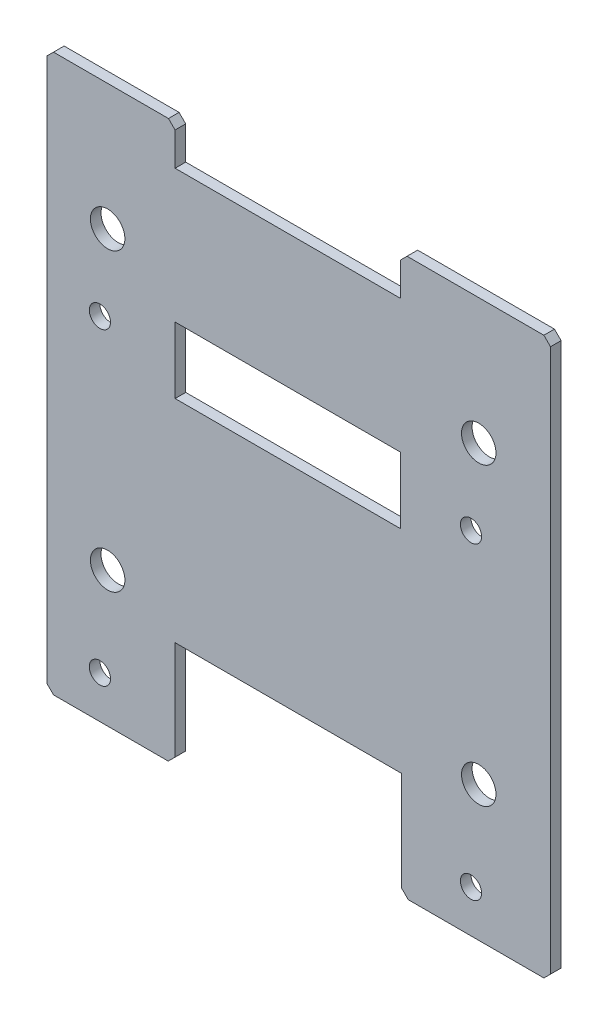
SolidWorks part; units mm, degrees
ref_plane "Front Plane" through (0, 0, 0) normal (0, 0, 1) x (1, 0, 0)
ref_plane "Top Plane" through (0, 0, 0) normal (0, 1, 0) x (1, 0, 0)
ref_plane "Right Plane" through (0, 0, 0) normal (1, 0, 0) x (0, 0, -1)
sketch "Sketch1" plane through (0, 0, 0) normal (0, 0, 1) x (1, 0, 0)
  line L0 (890, 770.5664) -> (890, 350.5664)
  line L1 (890, 350.5664) -> (777.6788, 350.5664)
  line L2 (777.6788, 350.5664) -> (777.6788, 430.5664)
  line L4 (777.6788, 430.5664) -> (606.5646, 430.5664)
  line L5 (606.5646, 430.5664) -> (606.5646, 350.5664)
  line L6 (606.5646, 350.5664) -> (510, 350.5664)
  line L7 (510, 350.5664) -> (510, 770.5664)
  line L8 (510, 770.5664) -> (606.7439, 770.5664)
  line L9 (606.7439, 770.5664) -> (606.7439, 740.5664)
  line L11 (606.7439, 740.5664) -> (776.7439, 740.5664)
  line L12 (776.7439, 740.5664) -> (776.7439, 770.5664)
  line L13 (776.7439, 770.5664) -> (890, 770.5664)
  point P5 (0, 0)
  point P6 (0, 0)
  point P13 (0, 0)
  point P14 (0, 0)
  point P16 (0, 0)
  dimension "D3" = 420
  dimension "D8" = 30
  dimension "D2" = 420
  dimension "D1" = 170
base flange "Base-Flange1" sketch "Sketch1" thickness 8 reverse thickness direction no parameters "D1"=0.7366
sketch "Sketch6" plane through (0, 0, 0) normal (0, 0, 1) x (1, 0, 0)
  circle A0 centre (555.8438, 452.5127) radius 13
  circle A1 centre (835.8438, 452.5127) radius 13
  circle A2 centre (555.8438, 675.5127) radius 13
  circle A3 centre (835.8438, 675.5127) radius 13
  dimension "D1" = 26
  dimension "D2" = 26
  dimension "D3" = 26
  dimension "D4" = 26
extrude "Cut-Extrude1" cut sketch "Sketch6" against normal blind 10
ref_plane "Plane1" through (0, 560.5664, 0) normal (0, -1, 0) x (-1, 0, 0)
break corner "Break-Corner1" thickness 8 parameters "D1"=5, "D7"=5
sketch "Sketch7" plane through (0, 0, 0) normal (0, 0, 1) x (1, 0, 0)
  line L0 (510, 350.5664) -> (510, 770.5664) construction
  line L1 (890, 770.5664) -> (890, 350.5664) construction
  circle A0 centre (550, 615.5127) radius 8
  circle A1 centre (830, 615.5127) radius 8
  circle A2 centre (550, 382.5127) radius 8
  circle A3 centre (830, 382.5127) radius 8
  circle A6 centre (555.8438, 452.5127) radius 13 construction
  circle A7 centre (835.8438, 452.5127) radius 13 construction
  circle A8 centre (555.8438, 675.5127) radius 13 construction
  circle A9 centre (835.8438, 675.5127) radius 13 construction
  point P8 (550, 642.2121)
  point P9 (550, 621.4906)
  point P13 (830, 610.5845)
  dimension "D2" = 40
  dimension "D3" = 16
  dimension "D4" = 16
  dimension "D5" = 60
  dimension "D6" = 60
  dimension "D7" = 16
  dimension "D8" = 60
  dimension "16" = 16
  dimension "D9" = 70
  dimension "D10" = 70
  dimension "D11" = 40
  dimension "D12" = 60
extrude "Cut-Extrude2" cut sketch "Sketch7" against normal blind 10
sketch "Sketch8" plane through (0, 0, -8) normal (0, 0, -1) x (-1, 0, 0)
  line L0 (-606.7439, 590.0791) -> (-606.7439, 640.0791)
  line L1 (-606.7439, 640.0791) -> (-776.7439, 640.0791)
  line L2 (-776.7439, 640.0791) -> (-776.7439, 590.0791)
  line L3 (-776.7439, 590.0791) -> (-606.7439, 590.0791)
extrude "Cut-Extrude3" cut sketch "Sketch8" against normal blind 10
sketch "Bend-Lines1" [suppressed] plane through (0, 0, 0) normal (0, 1, 0) x (1, 0, 0)
sketch "Bounding-Box1" [suppressed] plane through (0, 0, 0) normal (0, 1, 0) x (1, 0, 0)
sheet metal parameters "Sheet-Metal1" thickness 8 parameters "D1"=0.7366
flat pattern "Flat-Pattern1"
sketch "Bend-Lines2" plane through (0, 0, 0) normal (0, 1, 0) x (1, 0, 0)
sketch3d "Bounding-Box2" [suppressed]
  line L0 (510, 400.5664, 0) -> (890, 400.5664, 0) construction
  line L1 (510, 753, 0) -> (890, 753, 0) construction
  line L2 (510, 400.5664, 0) -> (510, 753, 0) construction
  line L3 (890, 400.5664, 0) -> (890, 753, 0) construction
sheet metal parameters "Sheet-Metal2" thickness 8 parameters "D1"=0.7366
flat pattern "Flat-Pattern1"
sketch "Bend-Lines2" plane through (0, 0, 0) normal (0, 1, 0) x (1, 0, 0)
sketch3d "Bounding-Box2" [suppressed]
  line L0 (510, 400.5664, 0) -> (890, 400.5664, 0) construction
  line L1 (510, 753, 0) -> (890, 753, 0) construction
  line L2 (510, 400.5664, 0) -> (510, 753, 0) construction
  line L3 (890, 400.5664, 0) -> (890, 753, 0) construction
sheet metal parameters "Sheet-Metal3" thickness 8 parameters "D1"=0.7366
flat pattern "Flat-Pattern1"
sketch "Bend-Lines2" plane through (0, 0, 0) normal (0, 1, 0) x (1, 0, 0)
sketch3d "Bounding-Box2" [suppressed]
  line L0 (890, 770.5664, 0) -> (890, 350.5664, 0) construction
  line L1 (510, 770.5664, 0) -> (510, 350.5664, 0) construction
  line L2 (890, 770.5664, 0) -> (510, 770.5664, 0) construction
  line L3 (890, 350.5664, 0) -> (510, 350.5664, 0) construction
sheet metal parameters "Sheet-Metal4" thickness 8 parameters "D1"=0.7366
flat pattern "Flat-Pattern1"
sketch "Bend-Lines2" plane through (0, 0, 0) normal (0, 1, 0) x (1, 0, 0)
sketch3d "Bounding-Box2" [suppressed]
  line L0 (890, 770.5664, 0) -> (890, 350.5664, 0) construction
  line L1 (510, 770.5664, 0) -> (510, 350.5664, 0) construction
  line L2 (890, 770.5664, 0) -> (510, 770.5664, 0) construction
  line L3 (890, 350.5664, 0) -> (510, 350.5664, 0) construction
